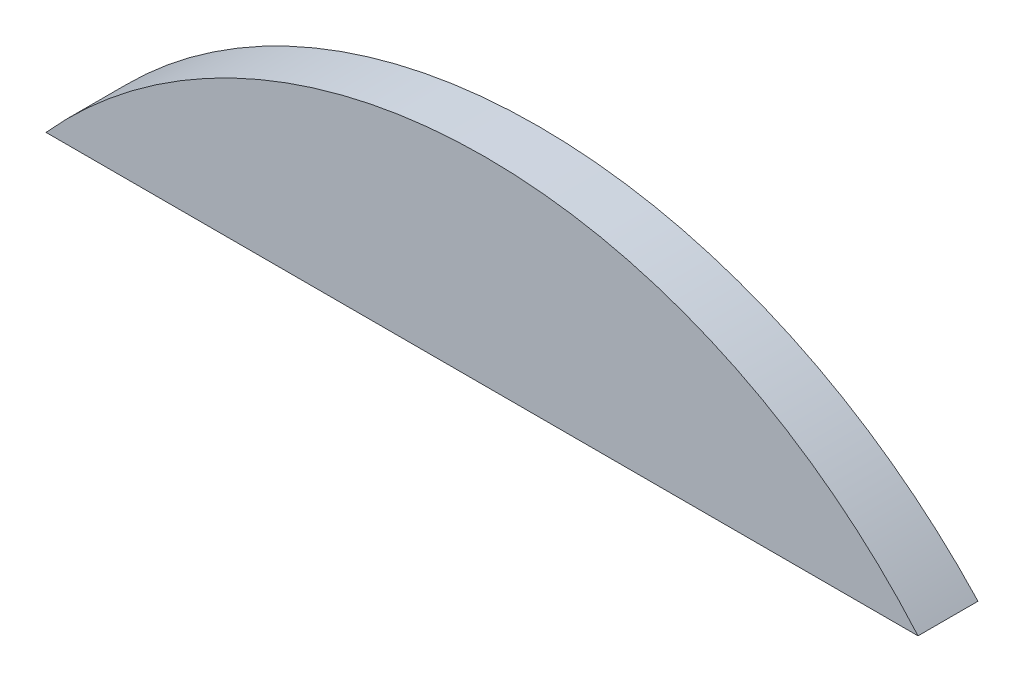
SolidWorks part; units mm, degrees
ref_plane "Vorderansicht" through (0, 0, 0) normal (0, 0, 1) x (1, 0, 0)
ref_plane "Draufsicht" through (0, 0, 0) normal (0, 1, 0) x (1, 0, 0)
ref_plane "Seitenansicht" through (0, 0, 0) normal (1, 0, 0) x (0, 0, -1)
sketch "Sketch1" plane through (0, 0, 0) normal (0, 0, 1) x (1, 0, 0)
  line L0 (-24.5967, 22) -> (24.5967, 22)
  arc A0 (24.5967, 22) -> (-24.5967, 22) centre (0, 0) ccw
  dimension "D1" = 33
  dimension "D2" = 22
extrude "Extrude1" add sketch "Sketch1" along normal mid plane 3
ref_plane "Plane1" through (0, 33, 0) normal (0, 1, 0) x (1, 0, 0)
draft "Draft1" type of draft neutral plane draft angle 1 neutral plane "Plane1" faces to draft 2 parameters "D1"=1
